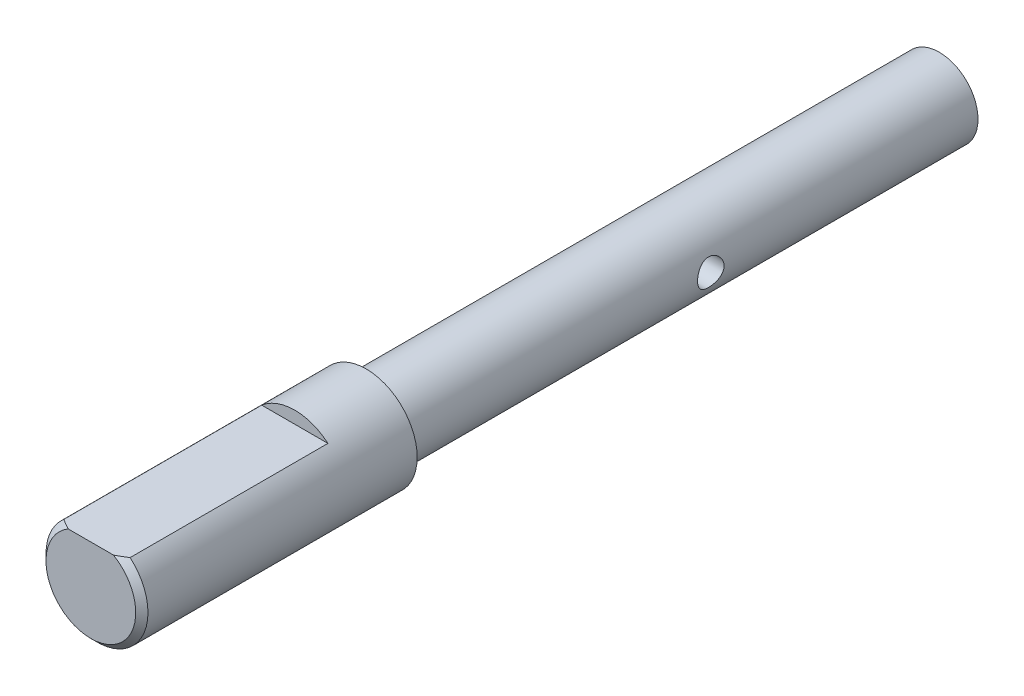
SolidWorks part; units mm, degrees
ref_plane "Front Plane" through (0, 0, 0) normal (0, 0, 1) x (1, 0, 0)
ref_plane "Top Plane" through (0, 0, 0) normal (0, 1, 0) x (1, 0, 0)
ref_plane "Right Plane" through (0, 0, 0) normal (1, 0, 0) x (0, 0, -1)
sketch "Sketch1" plane through (0, 0, 0) normal (0, 0, 1) x (1, 0, 0)
  circle A0 centre (0, 0) radius 4.826
  dimension "D1" = 9.652
extrude "Boss-Extrude1" add sketch "Sketch1" along normal blind 71.374 contours A0
sketch "Sketch2" plane through (0, 0, 71.374) normal (0, 0, 1) x (1, 0, 0)
  circle A0 centre (0, 0) radius 6.35
  dimension "D1" = 12.7
extrude "Boss-Extrude2" add sketch "Sketch2" along normal blind 34.29
chamfer "Chamfer1" distance 0.762 angle 45 1 edges at (6.35, 0, 105.664)
sketch "Sketch3" plane through (0, 0, 105.664) normal (0, 0, 1) x (1, 0, 0)
  line L0 (-9.0383, 4.826) -> (8.2384, 4.826)
  line L1 (8.2384, 4.826) -> (8.2384, 6.35)
  line L2 (8.2384, 6.35) -> (-9.0383, 6.35)
  line L3 (-9.0383, 6.35) -> (-9.0383, 4.826)
  circle A0 centre (0, 0) radius 6.35 construction
  dimension "D1" = 1.524
extrude "Cut-Extrude1" cut sketch "Sketch3" against normal blind 25.4 contours L2 L3 L0 L1
sketch "Sketch5" plane through (0, 0, 0) normal (1, 0, 0) x (0, 0, -1)
  circle A0 centre (-33.274, 0) radius 1.651
  dimension "D1" = 3.302
  dimension "D2" = 33.274
extrude "Cut-Extrude2" cut sketch "Sketch5" against normal through all and the other way through all
